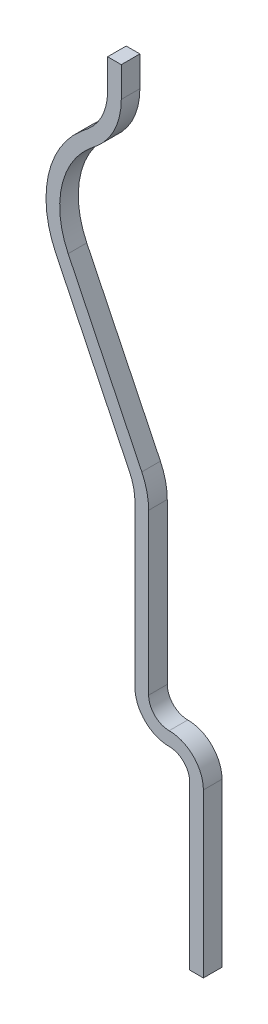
SolidWorks part; units mm, degrees
ref_plane "Front" through (0, 0, 0) normal (0, 0, 1) x (1, 0, 0)
ref_plane "Top" through (0, 0, 0) normal (0, 1, 0) x (1, 0, 0)
ref_plane "Right" through (0, 0, 0) normal (1, 0, 0) x (0, 0, -1)
sketch "Sketch1" plane through (0, 0, 0) normal (0, 0, 1) x (1, 0, 0)
  line L0 (0, 0) -> (0, 13.7) construction
  line L1 (0, 0) -> (0, -0.5) construction
  line L2 (-1, -0.5) -> (1, -0.5) construction
  line L3 (1, -0.5) -> (1, 0) construction
  line L4 (-1, -0.5) -> (-1, 0) construction
  line L5 (-1.125, 0) -> (-0.875, 0) construction
  line L6 (0.875, 0) -> (1.125, 0)
  line L7 (0, 3.1) -> (0.5, 3.1) construction
  line L8 (0.125, 6.9) -> (0.125, 3.975)
  line L9 (0.875, 0) -> (0.875, 2.975)
  line L10 (-0.125, 6.9) -> (-0.125, 3.975)
  line L11 (1.125, 0) -> (1.125, 2.975)
  line L12 (-1, -0.5) -> (-2.25, -0.5) construction
  line L13 (-2.25, -0.5) -> (-2.25, 13.7) construction
  line L14 (-0.2249, 7.3356) -> (-1.5703, 10.116)
  line L15 (-1.3452, 10.2248) -> (0.0002, 7.4445)
  line L16 (-0.625, 13.7) -> (-0.375, 13.7)
  line L17 (-0.625, 13.7) -> (-0.625, 13.15)
  line L18 (-0.981, 12.385) -> (-1.1093, 12.277)
  line L19 (-0.375, 13.7) -> (-0.375, 13.15)
  line L20 (-0.82, 12.1938) -> (-0.9483, 12.0857)
  arc A0 (0.875, 2.975) -> (0.5, 3.35) centre (0.5, 2.975) ccw
  arc A1 (0.5, 3.35) -> (-0.125, 3.975) centre (0.5, 3.975) cw
  arc A2 (0.125, 3.975) -> (0.5, 3.6) centre (0.5, 3.975) ccw
  arc A3 (0.5, 3.6) -> (1.125, 2.975) centre (0.5, 2.975) cw
  arc A4 (-0.9483, 12.0857) -> (-1.3452, 10.2248) centre (0.05, 10.9) ccw
  arc A5 (-1.1093, 12.277) -> (-1.5703, 10.116) centre (0.05, 10.9) ccw
  arc A6 (-0.125, 6.9) -> (-0.2249, 7.3356) centre (-1.125, 6.9) ccw
  arc A7 (0.125, 6.9) -> (0.0002, 7.4445) centre (-1.125, 6.9) ccw
  arc A8 (-0.625, 13.15) -> (-0.981, 12.385) centre (-1.625, 13.15) cw
  arc A9 (-0.375, 13.15) -> (-0.82, 12.1938) centre (-1.625, 13.15) cw
  dimension "D6" = 7.8
  dimension "D5" = 0.125
  dimension "D8" = 1.55
  dimension "D9" = 1.8
  dimension "D12" = 1
  dimension "D13" = 3.25
  dimension "D1" = 0.5
  dimension "D2" = 2
  dimension "D3" = 0.25
  dimension "D4" = 3.1
  dimension "D7" = 1.25
  dimension "D10" = 1
  dimension "D11" = 4
  dimension "D15" = 0.25
  dimension "D16" = 2.8
  dimension "D17" = 2.25
extrude "Pin External Bend" add sketch "Sketch1" along normal blind 0.34
sketch "Sketch2" [suppressed] plane through (0, 0, 0) normal (0, 0, 1) x (1, 0, 0)
  line L0 (0, 0) -> (0, 13.7) construction
  line L1 (0, 0) -> (0, -0.5) construction
  line L2 (-1, -0.5) -> (1, -0.5) construction
  line L3 (1, -0.5) -> (1, 0) construction
  line L4 (-1, -0.5) -> (-1, 0) construction
  line L5 (-1.125, 0) -> (-0.875, 0)
  line L6 (0.875, 0) -> (1.125, 0) construction
  line L7 (0, 3.1) -> (0.5, 3.1) construction
  line L8 (0.125, 6.9) -> (0.125, 3.975)
  line L10 (-0.125, 6.9) -> (-0.125, 3.975)
  line L12 (-1, -0.5) -> (-2.25, -0.5) construction
  line L13 (-2.25, -0.5) -> (-2.25, 13.7) construction
  line L14 (-0.2249, 7.3356) -> (-1.5703, 10.116)
  line L15 (-1.3452, 10.2248) -> (0.0002, 7.4445)
  line L16 (-0.625, 13.7) -> (-0.375, 13.7)
  line L17 (-0.625, 13.7) -> (-0.625, 13.15)
  line L18 (-0.981, 12.385) -> (-1.1093, 12.277)
  line L19 (-0.375, 13.7) -> (-0.375, 13.15)
  line L20 (-0.82, 12.1938) -> (-0.9483, 12.0857)
  line L21 (-1.125, 0) -> (-1.125, 2.975)
  line L22 (-0.875, 0) -> (-0.875, 2.975)
  arc A4 (-0.9483, 12.0857) -> (-1.3452, 10.2248) centre (0.05, 10.9) ccw
  arc A5 (-1.1093, 12.277) -> (-1.5703, 10.116) centre (0.05, 10.9) ccw
  arc A6 (-0.125, 6.9) -> (-0.2249, 7.3356) centre (-1.125, 6.9) ccw
  arc A7 (0.125, 6.9) -> (0.0002, 7.4445) centre (-1.125, 6.9) ccw
  arc A8 (-0.625, 13.15) -> (-0.981, 12.385) centre (-1.625, 13.15) cw
  arc A9 (-0.375, 13.15) -> (-0.82, 12.1938) centre (-1.625, 13.15) cw
  arc A10 (-0.875, 2.975) -> (-0.5, 3.35) centre (-0.5, 2.975) cw
  arc A11 (-0.5, 3.6) -> (-1.125, 2.975) centre (-0.5, 2.975) ccw
  arc A12 (-0.125, 3.975) -> (-0.5, 3.6) centre (-0.5, 3.975) cw
  arc A13 (-0.5, 3.35) -> (0.125, 3.975) centre (-0.5, 3.975) ccw
  dimension "D10" = 1
  dimension "D15" = 1.8
  dimension "D16" = 1.55
  dimension "D1" = 0.5
  dimension "D2" = 2
  dimension "D3" = 0.25
  dimension "D4" = 2.3
  dimension "D5" = 0.125
  dimension "D6" = 7.8
  dimension "D7" = 1.25
  dimension "D8" = 1
  dimension "D9" = 4
  dimension "D11" = 3.25
  dimension "D12" = 0.25
  dimension "D13" = 2.25
  dimension "D14" = 2.8
extrude "Pin Internal Bend" [suppressed] add sketch "Sketch2" along normal blind 0.34
